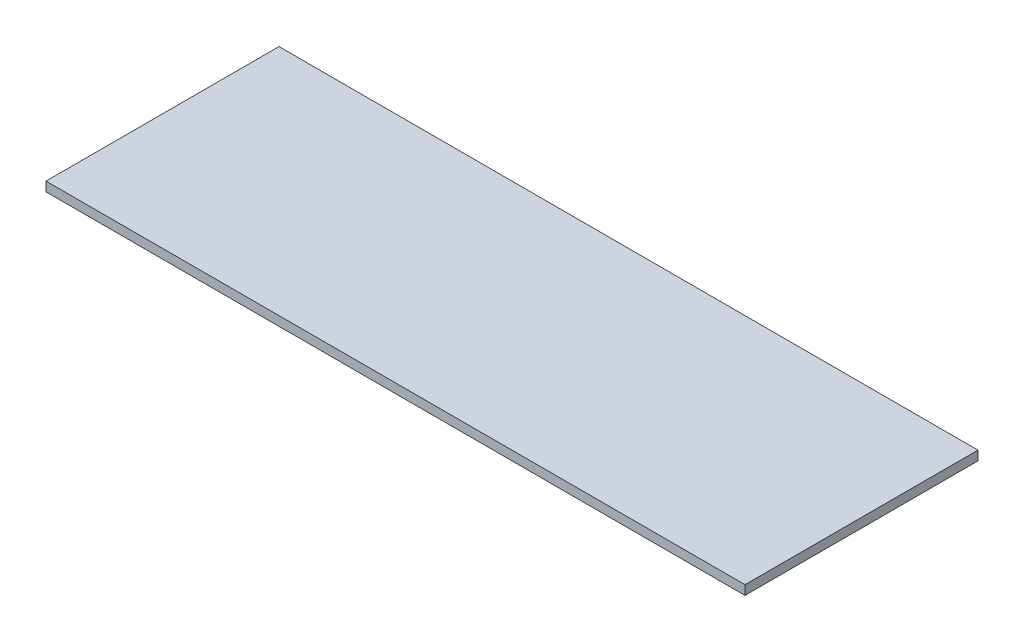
SolidWorks part; units mm, degrees
ref_plane "Plan de face" through (0, 0, 0) normal (0, 0, 1) x (1, 0, 0)
ref_plane "Plan de dessus" through (0, 0, 0) normal (0, 1, 0) x (1, 0, 0)
ref_plane "Plan de droite" through (0, 0, 0) normal (1, 0, 0) x (0, 0, -1)
sketch "Esquisse1" plane through (0, 0, 0) normal (0, 1, 0) x (1, 0, 0)
  line L1 (0, 0) -> (75, 0)
  line L2 (0, 0) -> (0, 25)
  line L3 (0, 25) -> (75, 25)
  line L4 (75, 0) -> (75, 25)
  dimension "D1" = 75
  dimension "D2" = 25
extrude "Extrusion1" add sketch "Esquisse1" along normal blind 1
